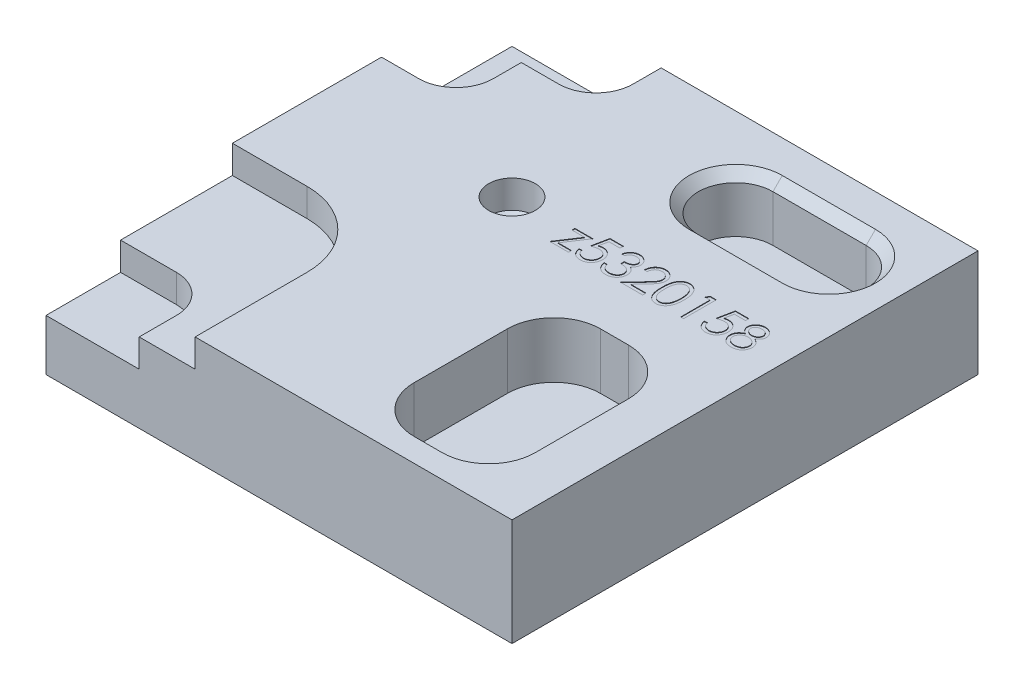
SolidWorks part; units mm, degrees
ref_plane "Front Plane" through (0, 0, 0) normal (0, 0, 1) x (1, 0, 0)
ref_plane "Top Plane" through (0, 0, 0) normal (0, 1, 0) x (1, 0, 0)
ref_plane "Right Plane" through (0, 0, 0) normal (1, 0, 0) x (0, 0, -1)
sketch "Sketch1" plane through (0, 0, 0) normal (0, 1, 0) x (1, 0, 0)
  line L0 (-4.643, 19.7567) -> (-4.643, 16.7567)
  line L1 (-20.643, 19.7567) -> (29.357, 19.7567)
  line L2 (-20.643, 19.7567) -> (-20.643, -30.2433)
  line L3 (-20.643, -30.2433) -> (29.357, -30.2433)
  line L4 (29.357, 19.7567) -> (29.357, -30.2433)
  line L5 (-20.643, 5.7567) -> (-16.643, 5.7567)
  line L6 (-12.643, 12.7567) -> (-12.643, 9.7567)
  line L7 (-12.643, 9.7567) -> (-12.643, 12.7567)
  line L8 (-8.643, 12.7567) -> (-12.643, 12.7567)
  line L9 (11.857, 7.2567) -> (21.857, 7.2567)
  line L15 (11.857, 15.2567) -> (21.857, 15.2567)
  line L17 (-20.643, -10.2433) -> (-12.643, -10.2433)
  line L18 (16.357, -5.2433) -> (19.357, -5.2433)
  line L19 (11.357, -10.2433) -> (11.357, -22.7433)
  line L20 (16.357, -27.7433) -> (19.357, -27.7433)
  line L21 (24.357, -10.2433) -> (24.357, -22.7433)
  line L22 (-4.643, -18.2433) -> (-4.643, -30.2433)
  line L23 (-20.643, -22.2433) -> (-14.643, -22.2433)
  line L24 (-10.643, -26.2433) -> (-10.643, -30.2433)
  arc A0 (-16.643, 5.7567) -> (-12.643, 9.7567) centre (-16.643, 9.7567) ccw
  arc A1 (-8.643, 12.7567) -> (-4.643, 16.7567) centre (-8.643, 16.7567) ccw
  arc A2 (21.857, 15.2567) -> (21.857, 7.2567) centre (21.857, 11.2567) cw
  arc A3 (11.857, 15.2567) -> (11.857, 7.2567) centre (11.857, 11.2567) ccw
  arc A4 (16.357, -5.2433) -> (11.357, -10.2433) centre (16.357, -10.2433) ccw
  arc A5 (24.357, -10.2433) -> (19.357, -5.2433) centre (19.357, -10.2433) ccw
  arc A6 (19.357, -27.7433) -> (24.357, -22.7433) centre (19.357, -22.7433) ccw
  arc A7 (11.357, -22.7433) -> (16.357, -27.7433) centre (16.357, -22.7433) ccw
  arc A8 (-10.643, -26.2433) -> (-14.643, -22.2433) centre (-14.643, -26.2433) ccw
  arc A9 (-4.643, -18.2433) -> (-12.643, -10.2433) centre (-12.643, -18.2433) ccw
  circle A10 centre (-0.643, -0.2433) radius 1.5
  circle A11 centre (-0.643, -0.2433) radius 2.5
  point P41 (-16.643, -10.2433)
  dimension "D7" = 4
  dimension "D8" = 4
  dimension "D11" = 4.5
  dimension "D13" = 5
  dimension "D14" = 5
  dimension "D15" = 5
  dimension "D16" = 5
  dimension "D21" = 4
  dimension "D22" = 8
  dimension "D27" = 3
  dimension "D28" = 5
  dimension "D1" = 50
  dimension "D2" = 50
  dimension "D3" = 14
  dimension "D4" = 16
  dimension "D5" = 8
  dimension "D6" = 7
  dimension "D9" = 10
  dimension "D10" = 8
  dimension "D12" = 7.5
  dimension "D17" = 22.5
  dimension "D18" = 18
  dimension "D19" = 5
  dimension "D20" = 2.5
  dimension "D23" = 10
  dimension "D24" = 20
  dimension "D25" = 8
  dimension "D26" = 16
  dimension "D29" = 30
  dimension "D30" = 20
extrude "Boss-Extrude1" add sketch "Sketch1" along normal blind 11.5 contours L3 L4 L1 L2
sketch "Sketch3" plane through (0, 11.5, 0) normal (0, 1, 0) x (1, 0, 0)
  line L0 (-20.643, -10.2433) -> (-12.643, -10.2433)
  line L1 (-20.643, 19.7567) -> (-20.643, -30.2433) construction
  line L2 (-4.643, -18.2433) -> (-4.643, -30.2433)
  line L3 (-20.643, -30.2433) -> (29.357, -30.2433) construction
  line L8 (-20.643, 19.7567) -> (-20.643, -30.2433)
  line L9 (-20.643, -30.2433) -> (29.357, -30.2433)
  line L10 (29.357, -30.2433) -> (29.357, 19.7567)
  line L11 (29.357, 19.7567) -> (-20.643, 19.7567)
  line L12 (-20.643, -10.2433) -> (-20.643, -30.2433)
  line L13 (-20.643, -30.2433) -> (-4.643, -30.2433)
  arc A0 (-4.643, -18.2433) -> (-12.643, -10.2433) centre (-12.643, -18.2433) ccw
  dimension "D1" = 8
  dimension "D2" = 20
  dimension "D3" = 16
  dimension "D4" = 0
extrude "Cut-Extrude1" cut sketch "Sketch3" against normal blind 3 contours L0 A0 L2 L13 L12
sketch "Sketch7" plane through (0, 8.5, 0) normal (0, 1, 0) x (1, 0, 0)
  line L0 (-20.643, -22.2433) -> (-14.643, -22.2433)
  line L1 (-20.643, -10.2433) -> (-20.643, -30.2433) construction
  line L2 (-10.643, -26.2433) -> (-10.643, -30.2433)
  line L3 (-20.643, -30.2433) -> (-4.643, -30.2433) construction
  arc A0 (-10.643, -26.2433) -> (-14.643, -22.2433) centre (-14.643, -26.2433) ccw
  dimension "D1" = 4
  dimension "D2" = 8
  dimension "D3" = 10
extrude "Cut-Extrude4" cut sketch "Sketch7" against normal blind 3 and the other way through all flip side to cut
sketch "Sketch8" plane through (0, 11.5, 0) normal (0, 1, 0) x (1, 0, 0)
  line L0 (-4.643, -30.2433) -> (29.357, -30.2433) construction
  line L1 (16.357, -7.7433) -> (19.357, -7.7433)
  line L2 (11.357, -12.7433) -> (11.357, -22.7433)
  line L3 (16.357, -27.7433) -> (19.357, -27.7433)
  line L4 (24.357, -12.7433) -> (24.357, -22.7433)
  line L5 (29.357, 19.7567) -> (29.357, -30.2433) construction
  arc A0 (16.357, -27.7433) -> (11.357, -22.7433) centre (16.357, -22.7433) cw
  arc A1 (19.357, -27.7433) -> (24.357, -22.7433) centre (19.357, -22.7433) ccw
  arc A2 (24.357, -12.7433) -> (19.357, -7.7433) centre (19.357, -12.7433) ccw
  arc A3 (16.357, -7.7433) -> (11.357, -12.7433) centre (16.357, -12.7433) ccw
  dimension "D1" = 5
  dimension "D2" = 22.5
  dimension "D3" = 2.5
  dimension "D4" = 5
  dimension "D5" = 18
extrude "Cut-Extrude5" cut sketch "Sketch8" against normal blind 6
sketch "Sketch9" plane through (0, 11.5, 0) normal (0, 1, 0) x (1, 0, 0)
  line L0 (-4.643, -30.2433) -> (29.357, -30.2433) construction
  line L1 (-20.643, 19.7567) -> (-20.643, -10.2433) construction
  circle A0 centre (-0.643, -0.2433) radius 1.5
  dimension "D1" = 3
  dimension "D2" = 30
  dimension "D3" = 20
sketch "Sketch11" plane through (0, 11.5, 0) normal (0, 1, 0) x (1, 0, 0)
  line L0 (29.357, 19.7567) -> (29.357, -30.2433) construction
  line L1 (11.857, 15.2567) -> (21.857, 15.2567)
  line L3 (11.857, 7.2567) -> (21.857, 7.2567)
  line L7 (-20.643, 19.7567) -> (29.357, 19.7567) construction
  arc A0 (21.857, 15.2567) -> (21.857, 7.2567) centre (21.857, 11.2567) cw
  arc A1 (11.857, 15.2567) -> (11.857, 7.2567) centre (11.857, 11.2567) ccw
  dimension "D1" = 10
  dimension "D3" = 8
  dimension "D2" = 7.5
  dimension "D4" = 4.5
extrude "Cut-Extrude8" cut sketch "Sketch11" against normal blind 6
sketch "Sketch12" plane through (0, 11.5, 0) normal (0, 1, 0) x (1, 0, 0)
  line L0 (-20.643, 5.7567) -> (-16.643, 5.7567)
  line L1 (-20.643, 19.7567) -> (-20.643, -10.2433) construction
  line L2 (-4.643, 19.7567) -> (-4.643, 16.7567)
  line L4 (-8.643, 12.7567) -> (-12.643, 12.7567)
  line L5 (-12.643, 12.7567) -> (-12.643, 9.7567)
  line L6 (-20.643, 19.7567) -> (29.357, 19.7567) construction
  arc A0 (-12.643, 9.7567) -> (-16.643, 5.7567) centre (-16.643, 9.7567) cw
  arc A1 (-8.643, 12.7567) -> (-4.643, 16.7567) centre (-8.643, 16.7567) ccw
  point P16 (-12.643, 11.2567)
  dimension "D1" = 4
  dimension "D2" = 4
  dimension "D3" = 14
  dimension "D4" = 16
  dimension "D5" = 8
  dimension "D6" = 7
extrude "Cut-Extrude11" cut sketch "Sketch12" against normal blind 6 and the other way through all flip side to cut contours L2 A1 L4 L5 A0 L0
chamfer "Chamfer1" distance 1 angle 45 4 edges at (7.857, 11.5, -11.2567) (16.857, 11.5, -7.2567) (25.857, 11.5, -11.2567) (16.857, 11.5, -15.2567)
hole_wizard "Ø3.0mm Dowel Hole1" positions "3DSketch3" profile "Sketch15" hole size "Ø3.0" standard "ANSI Metric"
sketch3d "3DSketch3"
  point P0 (-0.643, 11.5, 0.2433)
sketch "Sketch15" plane through (-0.643, 11.5, 0.2433) normal (1, 0, 0) x (0, 0, 1)
  line L0 (0, 0) -> (0, 6.9013)
  line L1 (0, 6.9013) -> (1.5, 6)
  line L2 (1.5, 6) -> (1.5, 0.025)
  line L3 (1.5, 0.025) -> (1.525, 0)
  line L5 (1.525, 0) -> (0, 0)
  line L6 (-1.5, 0.025) -> (-1.525, 0) construction
  line L10 (0, 6.9013) -> (-1.5, 6) construction
  line L11 (0, -6.35) -> (0, 107.95) construction
  dimension "Hole Dia." = 3
  dimension "Hole Depth" = 6
  dimension "Near C'Sink Dia." = 3.05
  dimension "Near C'Sink Angle" = 90
  dimension "Drill Angle" = 118
hole_wizard "Ø5.0mm Dowel Hole1" positions "3DSketch4" profile "Sketch16" hole size "Ø5.0" standard "ANSI Metric"
sketch3d "3DSketch4"
  point P0 (-0.643, 11.5, 0.2433)
sketch "Sketch16" plane through (-0.643, 11.5, 0.2433) normal (1, 0, 0) x (0, 0, 1)
  line L0 (0, 0) -> (0, 4.5022)
  line L1 (0, 4.5022) -> (2.5, 3)
  line L2 (2.5, 3) -> (2.5, 0)
  line L5 (2.5, 0) -> (0, 0)
  line L10 (0, 4.5022) -> (-2.5, 3) construction
  line L11 (0, -6.35) -> (0, 107.95) construction
  dimension "Hole Dia." = 5
  dimension "Hole Depth" = 3
  dimension "Drill Angle" = 118
sketch "Engrave" plane through (0, 11.5, 0) normal (0, 1, 0) x (1, 0, 0)
  text T0 "z5320158"
extrude "Engrave cut" cut sketch "Engrave" against normal blind 0.05
